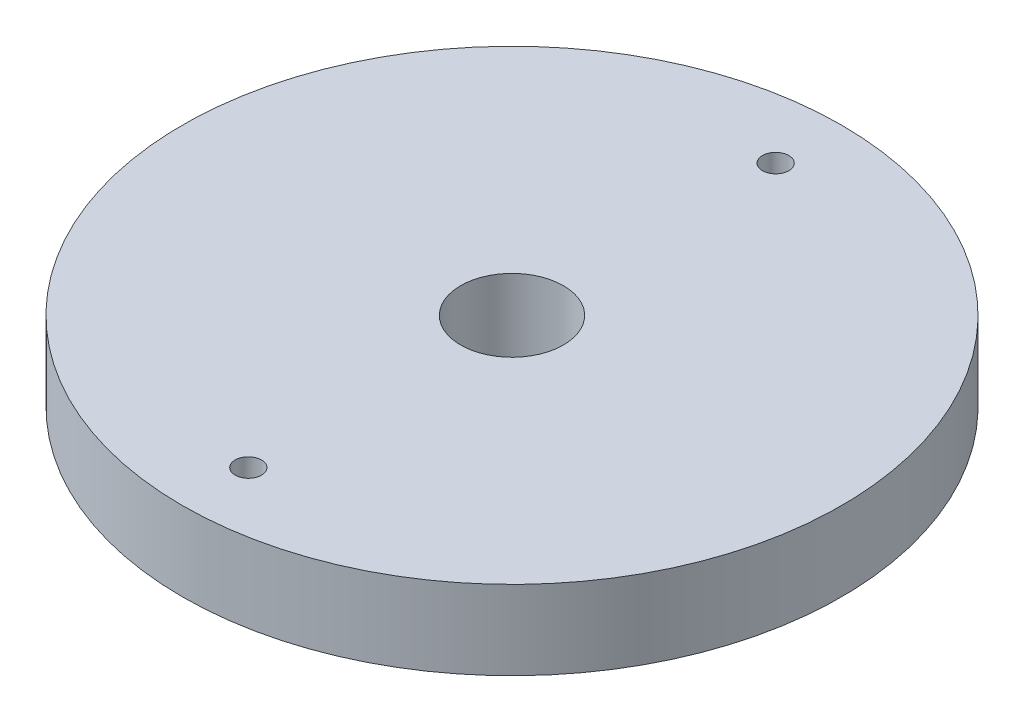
SolidWorks part; units mm, degrees
ref_plane "Front Plane" through (0, 0, 0) normal (0, 0, 1) x (1, 0, 0)
ref_plane "Top Plane" through (0, 0, 0) normal (0, 1, 0) x (1, 0, 0)
ref_plane "Right Plane" through (0, 0, 0) normal (1, 0, 0) x (0, 0, -1)
sketch "Sketch1" plane through (0, 0, 0) normal (0, 1, 0) x (1, 0, 0)
  circle A0 centre (0, 0) radius 12.5
  dimension "D1" = 25
extrude "Boss-Extrude1" add sketch "Sketch1" along normal blind 3
sketch "Sketch2" plane through (0, 0, 0) normal (0, 1, 0) x (1, 0, 0)
  line L0 (0, 0) -> (0, 12.5) construction
  line L1 (-12.5, 0) -> (12.5, 0) construction
  circle A0 centre (0, 0) radius 12.5 construction
  circle A1 centre (0, 0) radius 1.95
  circle A2 centre (0, 10) radius 0.5
  circle A3 centre (0, -10) radius 0.5
  dimension "D2" = 3.9
  dimension "D3" = 1
  dimension "D1" = 10
extrude "Cut-Extrude1" cut sketch "Sketch2" along normal up to next
